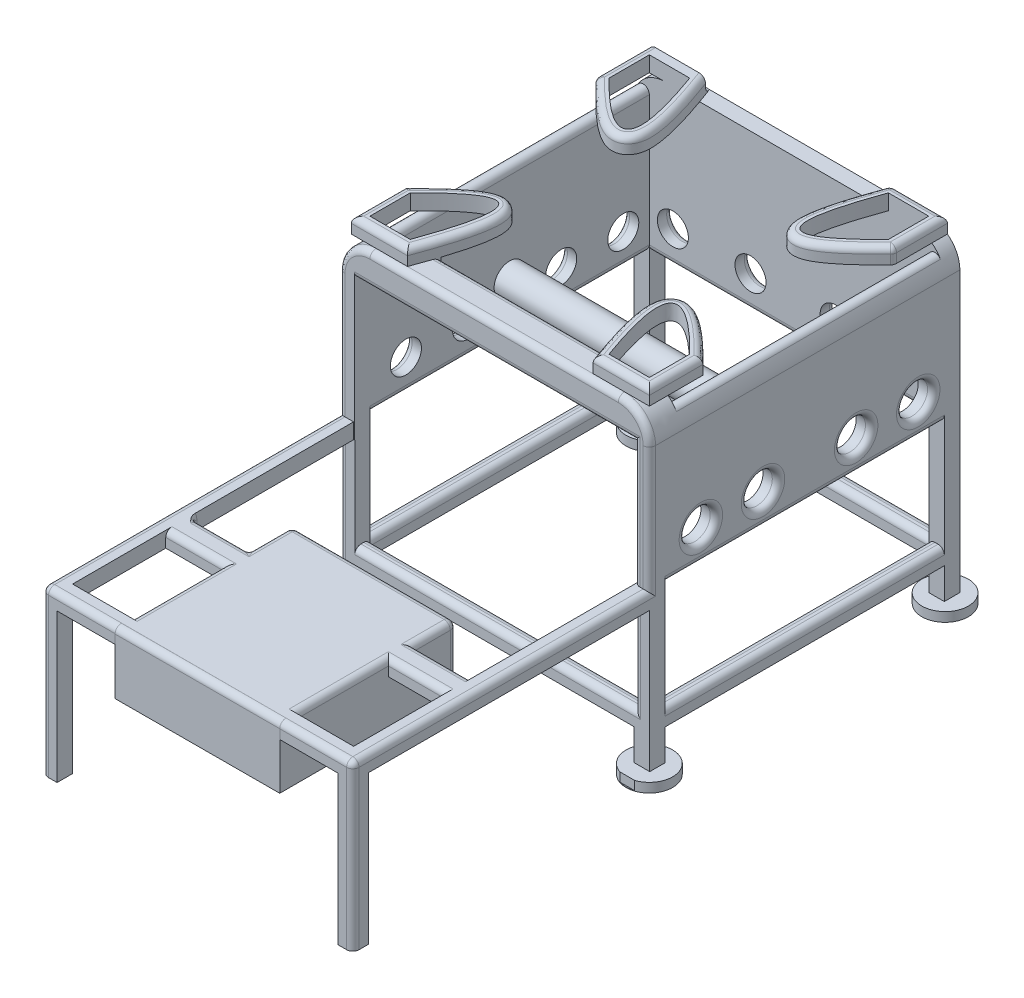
SolidWorks part; units mm, degrees
ref_plane "Front Plane" through (0, 0, 0) normal (0, 0, 1) x (1, 0, 0)
ref_plane "Top Plane" through (0, 0, 0) normal (0, 1, 0) x (1, 0, 0)
ref_plane "Right Plane" through (0, 0, 0) normal (1, 0, 0) x (0, 0, -1)
sketch "Sketch1" plane through (0, 0, 0) normal (0, 0, 1) x (1, 0, 0)
  line L1 (-50, 50) -> (50, 50)
  line L2 (-50, 50) -> (-50, -50)
  line L3 (-50, -50) -> (50, -50)
  line L4 (50, 50) -> (50, -50)
  point P0 (0, 0)
  dimension "D1" = 100
  dimension "D2" = 100
extrude "Boss-Extrude1" add sketch "Sketch1" along normal blind 100
sketch "Sketch2" plane through (0, 0, 100) normal (0, 0, 1) x (1, 0, 0)
  line L0 (50, -50) -> (50, 50) construction
  line L1 (-45, 45) -> (45, 45)
  line L2 (-45, 45) -> (-45, -51.7423)
  line L3 (-45, -51.7423) -> (45, -51.7423)
  line L4 (45, 45) -> (45, -51.7423)
  line L5 (-50, 50) -> (-50, -50) construction
  line L6 (50, 50) -> (-50, 50) construction
  point P6 (-45, -3.3711)
  dimension "D1" = 5
  dimension "D2" = 5
  dimension "D3" = 5
extrude "Cut-Extrude1" cut sketch "Sketch2" against normal blind 95
sketch "Sketch3" plane through (0, 50, 0) normal (0, 1, 0) x (1, 0, 0)
  line L0 (50, -100) -> (50, 0) construction
  line L1 (-45, -5) -> (45, -5)
  line L2 (-45, -5) -> (-45, -104.0415)
  line L3 (-45, -104.0415) -> (45, -104.0415)
  line L4 (45, -5) -> (45, -104.0415)
  line L5 (50, 0) -> (-50, 0) construction
  line L6 (-50, -100) -> (-50, 0) construction
  dimension "D1" = 5
  dimension "D2" = 5
  dimension "D3" = 5
extrude "Cut-Extrude2" cut sketch "Sketch3" against normal blind 95
sketch "Sketch4" plane through (50, 0, 0) normal (1, 0, 0) x (0, 0, -1)
  line L0 (0, -50) -> (0, 50) construction
  line L1 (-95, 0) -> (-5, 0)
  line L2 (-95, 0) -> (-95, -59.8667)
  line L3 (-95, -59.8667) -> (-5, -59.8667)
  line L4 (-5, 0) -> (-5, -59.8667)
  line L5 (-100, -50) -> (-100, 50) construction
  line L6 (-100, 50) -> (0, 50) construction
  dimension "D1" = 5
  dimension "D2" = 5
  dimension "D3" = 50
extrude "Cut-Extrude3" cut sketch "Sketch4" against normal blind 114
sketch "Sketch5" plane through (0, 0, 0) normal (0, 0, -1) x (-1, 0, 0)
  line L0 (50, 50) -> (50, -50) construction
  line L1 (-45, 0) -> (45, 0)
  line L2 (-45, 0) -> (-45, -59.6342)
  line L3 (-45, -59.6342) -> (45, -59.6342)
  line L4 (45, 0) -> (45, -59.6342)
  line L5 (-50, -50) -> (-50, 50) construction
  line L6 (-50, 50) -> (50, 50) construction
  dimension "D1" = 5
  dimension "D2" = 5
  dimension "D3" = 50
extrude "Cut-Extrude4" cut sketch "Sketch5" against normal blind 114
sketch "Sketch6" plane through (0, 0, 100) normal (0, 0, 1) x (1, 0, 0)
  line L0 (45, -50) -> (45, 50) construction
  line L1 (45, -35) -> (50, -35)
  line L2 (45, -35) -> (45, -40)
  line L3 (45, -40) -> (50, -40)
  line L4 (50, -35) -> (50, -40)
  line L5 (50, -50) -> (50, 50) construction
  line L6 (45, -50) -> (50, -50) construction
  dimension "D1" = 10
  dimension "D2" = 5
extrude "Boss-Extrude2" add sketch "Sketch6" against normal blind 100
sketch "Sketch7" plane through (0, 0, 100) normal (0, 0, 1) x (1, 0, 0)
  line L0 (-50, 50) -> (-50, -50) construction
  line L1 (-50, -40) -> (-45, -40)
  line L2 (-50, -40) -> (-50, -35)
  line L3 (-50, -35) -> (-45, -35)
  line L4 (-45, -40) -> (-45, -35)
  line L5 (-45, 50) -> (-45, -50) construction
  line L6 (-50, -50) -> (-45, -50) construction
  dimension "D1" = 10
  dimension "D2" = 5
extrude "Boss-Extrude3" add sketch "Sketch7" against normal blind 100
sketch "Sketch8" plane through (-50, 0, 0) normal (-1, 0, 0) x (0, 0, 1)
  line L0 (100, 50) -> (100, -50) construction
  line L1 (95, -40) -> (100, -40)
  line L2 (95, -40) -> (95, -35)
  line L3 (95, -35) -> (100, -35)
  line L4 (100, -40) -> (100, -35)
  line L6 (100, -50) -> (95, -50) construction
  dimension "D1" = 10
  dimension "D2" = 5
extrude "Boss-Extrude4" add sketch "Sketch8" against normal blind 100
sketch "Sketch9" plane through (-50, 0, 0) normal (-1, 0, 0) x (0, 0, 1)
  line L0 (0, 50) -> (0, -50) construction
  line L1 (5, -35) -> (0, -35)
  line L2 (5, -35) -> (5, -40)
  line L3 (5, -40) -> (0, -40)
  line L4 (0, -35) -> (0, -40)
  line L5 (5, -50) -> (0, -50) construction
  dimension "D1" = 10
  dimension "D2" = 5
extrude "Boss-Extrude5" add sketch "Sketch9" against normal blind 100
sketch "Sketch10" plane through (0, -50, 0) normal (0, -1, 0) x (-1, 0, 0)
  line L0 (0, 0) -> (0, -100) construction
  line L1 (-45, -100) -> (45, -100) construction
  line L2 (-50, -50) -> (50, -50) construction
  line L3 (-50, -5) -> (-50, -95) construction
  line L4 (50, -5) -> (50, -95) construction
  circle A0 centre (47.6303, -97.6238) radius 7.5
  circle A1 centre (47.6303, -2.3762) radius 7.5
  circle A2 centre (-47.6303, -2.3762) radius 7.5
  circle A3 centre (-47.6303, -97.6238) radius 7.5
  dimension "D1" = 15
extrude "Boss-Extrude6" add sketch "Sketch10" along normal blind 3
sketch "Sketch11" plane through (0, 0, 100) normal (0, 0, 1) x (1, 0, 0)
  line L0 (50, -50) -> (50, 50) construction
  line L1 (-50, 50) -> (50, 50)
  line L2 (-50, 50) -> (-50, 40)
  line L3 (-50, 40) -> (50, 40)
  line L4 (50, 50) -> (50, 40)
  dimension "D1" = 10
extrude "Boss-Extrude7" add sketch "Sketch11" against normal blind 10
sketch "Sketch12" plane through (50, 0, 0) normal (1, 0, 0) x (0, 0, -1)
  line L0 (-50, 50) -> (-50, 0) construction
  line L1 (-100, 50) -> (0, 50) construction
  line L2 (-5, 0) -> (-95, 0) construction
  circle A0 centre (-50, 15) radius 5
  dimension "D1" = 10
  dimension "D2" = 15
extrude "Boss-Extrude8" add sketch "Sketch12" against normal blind 100
sketch "Sketch13" plane through (0, 0, 100) normal (0, 0, 1) x (1, 0, 0)
  line L0 (50, -50) -> (50, 50) construction
  line L1 (50, 0) -> (45.2592, 0)
  line L2 (50, 0) -> (50, -52.8656)
  line L3 (50, -52.8656) -> (45.2592, -52.8656)
  line L4 (45.2592, 0) -> (45.2592, -52.8656)
  line L5 (0, 50) -> (0, -62.7077) construction
  line L6 (50, 50) -> (-50, 50) construction
  line L7 (-50, -52.8656) -> (-45.2592, -52.8656)
  line L8 (-50, 0) -> (-45.2592, 0)
  line L9 (-50, 0) -> (-50, -52.8656)
  line L10 (-45.2592, 0) -> (-45.2592, -52.8656)
extrude "Boss-Extrude9" add sketch "Sketch13" along normal blind 95.49
sketch "Sketch14" plane through (50, 0, 0) normal (1, 0, 0) x (0, 0, -1)
  line L0 (-195.49, 0) -> (-100, 0) construction
  line L1 (-190.49, -5) -> (-104.7397, -5)
  line L2 (-190.49, -5) -> (-190.49, -52.8656)
  line L3 (-190.49, -52.8656) -> (-104.7397, -52.8656)
  line L4 (-104.7397, -5) -> (-104.7397, -52.8656)
  line L5 (-195.49, -52.8656) -> (-195.49, 0) construction
  dimension "D1" = 5
  dimension "D2" = 5
extrude "Cut-Extrude5" cut sketch "Sketch14" against normal blind 147.49
sketch "Sketch15" plane through (50, 0, 0) normal (1, 0, 0) x (0, 0, -1)
  line L1 (-195.49, 0) -> (-190.49, 0)
  line L2 (-195.49, 0) -> (-195.49, -5)
  line L3 (-195.49, -5) -> (-190.49, -5)
  line L4 (-190.49, 0) -> (-190.49, -5)
extrude "Boss-Extrude10" add sketch "Sketch15" against normal blind 100
sketch "Sketch18" plane through (0, 0, 0) normal (0, 1, 0) x (1, 0, 0)
  line L0 (-50, -195.49) -> (-50, -100) construction
  line L1 (50, -195.49) -> (-50, -195.49)
  line L2 (50, -195.49) -> (50, -152.49)
  line L3 (50, -152.49) -> (-50, -152.49)
  line L4 (-50, -195.49) -> (-50, -152.49)
  line L5 (-50, -160.49) -> (50, -160.49)
  line L6 (-50, -152.49) -> (-50, -160.49)
  line L7 (50, -152.49) -> (50, -160.49)
  dimension "D1" = 43
  dimension "D2" = 8
extrude "Boss-Extrude11" add sketch "Sketch18" against normal blind 5 contours L5 L3 M6 M4
sketch "Sketch19" plane through (50, 0, 0) normal (1, 0, 0) x (0, 0, -1)
  line L0 (-104.7397, -50) -> (-95, -50) construction
  line L1 (-104.7397, -5) -> (-99.8698, -5)
  line L2 (-104.7397, -5) -> (-104.7397, -50)
  line L3 (-104.7397, -50) -> (-99.8698, -50)
  line L4 (-99.8698, -5) -> (-99.8698, -50)
extrude "Cut-Extrude8" cut sketch "Sketch19" against normal blind 127
sketch "Sketch20" plane through (0, 0, 0) normal (0, 1, 0) x (1, 0, 0)
  line L0 (0, -160.49) -> (0, -190.49) construction
  line L1 (-45.2592, -160.49) -> (45.2592, -160.49) construction
  line L2 (-45.2592, -190.49) -> (45.2592, -190.49) construction
  line L3 (-26.4602, -195.607) -> (26.4602, -195.49)
  line L5 (-26.4602, -195.607) -> (-26.4602, -138.5589)
  line L6 (-26.4602, -138.5589) -> (26.4602, -138.5589)
  line L7 (26.4602, -195.49) -> (26.4602, -138.5589)
  line L8 (-14.3942, -195.5803) -> (26.4602, -138.5589) construction
  line L9 (-26.4602, -138.5589) -> (14.3487, -195.5168) construction
  line L10 (50, -195.49) -> (-50, -195.49) construction
  point P6 (0, -175.49)
  point P7 (0, -175.49)
extrude "Boss-Extrude16" add sketch "Sketch20" against normal blind 20
fillet "Fillet10" radius 10 1 edges at (50, 50, 50)
fillet "Fillet11" radius 10 1 edges at (-50, 50, 50)
sketch "Sketch21" plane through (0, 50, 0) normal (0, 1, 0) x (1, 0, 0)
  line L0 (0, 0) -> (0, -100) construction
  line L1 (40, -100) -> (-40, -100) construction
  line L2 (-50, -50) -> (50, -50) construction
  line L3 (-50, 0) -> (-50, -100) construction
  line L4 (50, -100) -> (50, 0) construction
sketch "Sketch22" plane through (0, 50, 0) normal (0, 1, 0) x (1, 0, 0)
  line L0 (-45, -5) -> (-45, -90) construction
  line L1 (40, -5) -> (-40, -5) construction
  line L2 (-45, -18) -> (-45, -5)
  line L3 (-45, -5) -> (-32, -5)
  line L4 (-48, -2) -> (-29.8949, -2)
  line L5 (-48, -19.2202) -> (-48, -2)
  line L6 (0, 0) -> (0, -100) construction
  line L7 (40, -100) -> (-40, -100) construction
  line L8 (-50, -50) -> (50, -50) construction
  line L9 (48, -19.2202) -> (48, -2)
  line L10 (45, -18) -> (45, -5)
  line L11 (48, -2) -> (29.8949, -2)
  line L12 (45, -5) -> (32, -5)
  line L13 (48, -98) -> (29.8949, -98)
  line L14 (45, -95) -> (32, -95)
  line L15 (45, -82) -> (45, -95)
  line L16 (48, -80.7798) -> (48, -98)
  line L17 (-45, -82) -> (-45, -95)
  line L18 (-48, -80.7798) -> (-48, -98)
  line L19 (-48, -98) -> (-29.8949, -98)
  line L20 (-45, -95) -> (-32, -95)
  spline S0 degree 2 poles (-45, -18) (-16.8532, -46.8772) (-32, -5) knots 0 0 0 1 1 1
  spline S1 degree 1 poles (-48, -19.2202) (-29.8949, -2) knots 0 0 1 1 construction
  spline S2 degree 2 poles (-48, -19.2202) (-47.3163, -19.9243) (-45.9352, -21.3307) (-43.9469, -23.3042) (-41.0728, -26.0003) (-38.1131, -28.5111) (-35.4451, -30.4652) (-33.0013, -31.8775) (-30.9101, -32.6326) (-29.2998, -32.8217) (-27.9195, -32.6835) (-26.5384, -32.1399) (-25.379, -31.2) (-24.5785, -30.0485) (-23.9697, -28.5332) (-23.6551, -26.3386) (-23.772, -23.5467) (-24.397, -19.509) (-25.9628, -13.4998) (-27.7421, -8.0436) (-28.7852, -5.0687) (-29.5272, -3.0162) (-29.8949, -2) knots -0.015129 -0.015129 -0.015129 0.009217 0.033563 0.082255 0.147178 0.212101 0.277023 0.341946 0.390638 0.4231 0.455561 0.488023 0.520484 0.552945 0.601638 0.66656 0.731483 0.828867 0.926252 0.974944 0.99929 1.023636 1.023636 1.023636
  spline S3 degree 2 poles (45, -18) (16.8532, -46.8772) (32, -5) knots 0 0 0 1 1 1
  spline S4 degree 2 poles (48, -19.2202) (47.3163, -19.9243) (45.9352, -21.3307) (43.9469, -23.3042) (41.0728, -26.0003) (38.1131, -28.5111) (35.4451, -30.4652) (33.0013, -31.8775) (30.9101, -32.6326) (29.2998, -32.8217) (27.9195, -32.6835) (26.5384, -32.1399) (25.379, -31.2) (24.5785, -30.0485) (23.9697, -28.5332) (23.6551, -26.3386) (23.772, -23.5467) (24.397, -19.509) (25.9628, -13.4998) (27.7421, -8.0436) (28.7852, -5.0687) (29.5272, -3.0162) (29.8949, -2) knots -0.015129 -0.015129 -0.015129 0.009217 0.033563 0.082255 0.147178 0.212101 0.277023 0.341946 0.390638 0.4231 0.455561 0.488023 0.520484 0.552945 0.601638 0.66656 0.731483 0.828867 0.926252 0.974944 0.99929 1.023636 1.023636 1.023636
  spline S5 degree 2 poles (48, -80.7798) (47.3163, -80.0757) (45.9352, -78.6693) (43.9469, -76.6958) (41.0728, -73.9997) (38.1131, -71.4889) (35.4451, -69.5348) (33.0013, -68.1225) (30.9101, -67.3674) (29.2998, -67.1783) (27.9195, -67.3165) (26.5384, -67.8601) (25.379, -68.8) (24.5785, -69.9515) (23.9697, -71.4668) (23.6551, -73.6614) (23.772, -76.4533) (24.397, -80.491) (25.9628, -86.5002) (27.7421, -91.9564) (28.7852, -94.9313) (29.5272, -96.9838) (29.8949, -98) knots -0.015129 -0.015129 -0.015129 0.009217 0.033563 0.082255 0.147178 0.212101 0.277023 0.341946 0.390638 0.4231 0.455561 0.488023 0.520484 0.552945 0.601638 0.66656 0.731483 0.828867 0.926252 0.974944 0.99929 1.023636 1.023636 1.023636
  spline S6 degree 2 poles (45, -82) (16.8532, -53.1228) (32, -95) knots 0 0 0 1 1 1
  spline S7 degree 2 poles (-45, -82) (-16.8532, -53.1228) (-32, -95) knots 0 0 0 1 1 1
  spline S8 degree 2 poles (-48, -80.7798) (-47.3163, -80.0757) (-45.9352, -78.6693) (-43.9469, -76.6958) (-41.0728, -73.9997) (-38.1131, -71.4889) (-35.4451, -69.5348) (-33.0013, -68.1225) (-30.9101, -67.3674) (-29.2998, -67.1783) (-27.9195, -67.3165) (-26.5384, -67.8601) (-25.379, -68.8) (-24.5785, -69.9515) (-23.9697, -71.4668) (-23.6551, -73.6614) (-23.772, -76.4533) (-24.397, -80.491) (-25.9628, -86.5002) (-27.7421, -91.9564) (-28.7852, -94.9313) (-29.5272, -96.9838) (-29.8949, -98) knots -0.015129 -0.015129 -0.015129 0.009217 0.033563 0.082255 0.147178 0.212101 0.277023 0.341946 0.390638 0.4231 0.455561 0.488023 0.520484 0.552945 0.601638 0.66656 0.731483 0.828867 0.926252 0.974944 0.99929 1.023636 1.023636 1.023636
  dimension "D1" = 13
  dimension "D2" = 13
  dimension "D3" = 3
extrude "Boss-Extrude17" add sketch "Sketch22" along normal blind 5
fillet "Fillet13" radius 2 1 edges
fillet "Fillet14" radius 2 6 edges at (48, 51.5, 19.2202) (48, 54.3446, 18.4746) (29.8949, 51.5, 2) (30.3151, 54.1936, 2) (48, 55, 9.1747) (40.0109, 55, 2)
fillet "Fillet15" radius 2 3 edges at (38.9474, 55, 98) (48, 55, 89.3899)
fillet "Fillet16" radius 2 3 edges at (-48, 55, 89.3899) (-38.9474, 55, 98)
fillet "Fillet17" radius 2 1 edges
fillet "Fillet18" radius 2 8 edges at (-48, 55, 9.1747) (-27.344, 55, 30.2128) (-48, 51.5, 19.2202) (-48, 53.9728, 18.8577)
fillet "Fillet20" radius 2 1 edges at (-50, 0, 147.745)
fillet "Fillet21" radius 2 1 edges at (50, 0, 147.745)
fillet "Fillet22" radius 2 4 edges at (50, -27.4328, 195.49) (49.4142, -0.5858, 195.49) (37.2301, 0, 195.49) (0, 0, 195.5485)
fillet "Fillet23" radius 2 4 edges at (-50, -27.4328, 195.49) (-49.9574, -1.5893, 195.49) (-37.6325, -1.2605, 195.49) (-49.0936, -0.3255, 194.7507)
fillet "Fillet24" radius 2 1 edges at (50, -35, 50)
fillet "Fillet25" radius 2 1 edges at (0, -35, 95)
fillet "Fillet27" radius 2 1 edges at (-50, -35, 50)
fillet "Fillet28" radius 2 1 edges at (-45, -35, 50)
fillet "Fillet29" radius 2 1 edges at (0, -35, 99.8698)
fillet "Fillet31" radius 2 1 edges at (0, -35, 0)
fillet "Fillet33" radius 2 1 edges at (0, -35, 5)
fillet "Fillet34" radius 2 1 edges at (-35.8597, 0, 160.49)
fillet "Fillet35" radius 2 1 edges at (35.8597, 0, 160.49)
fillet "Fillet36" radius 2 1 edges at (35.8597, 0, 152.49)
fillet "Fillet37" radius 2 1 edges at (-35.8597, 0, 152.49)
fillet "Fillet38" radius 2 4 edges at (-26.4602, -10, 138.5589) (0, -20, 138.5589) (26.4602, -10, 138.5589) (0, 0, 138.5589)
fillet "Fillet39" radius 2 1 edges at (-26.4602, 0, 174.49)
fillet "Fillet40" radius 2 2 edges at (-25.8744, -0.5858, 139.1447) (-26.4602, 0, 147.5245)
fillet "Fillet41" radius 2 2 edges at (25.8744, -0.5858, 139.1447) (26.4602, 0, 147.5245)
fillet "Fillet42" radius 2 1 edges at (26.4602, 0, 174.49)
fillet "Fillet44" radius 2 10 edges at (50, 19, 100) (0, 50, 100) (47.8087, 46.2469, 100) (-50, 19, 100) (-46.2469, 47.8087, 100) (-49.4142, -0.5858, 100) (49.4142, -0.5858, 100)
fillet "Fillet45" radius 2 1 edges at (-50, -27.5, 99.8698)
fillet "Fillet46" radius 2 1 edges at (45, -21, 99.8698)
fillet "Fillet47" radius 2 1 edges at (45, 17.5, 100)
fillet "Fillet48" radius 2 1 edges at (1, 40, 100)
fillet "Fillet52" radius 2 1 edges at (0, 50, 90)
fillet "Fillet53" radius 2 1 edges at (0, 40, 90)
fillet "Fillet54" radius 2 1 edges at (45, 48.6603, 47.5)
fillet "Fillet55" radius 2 5 edges at (-45.2592, -3.5, 152.49) (-26.4602, -3.5, 152.49) (-45.2592, -0.5858, 153.0758) (-25.8744, -0.5858, 153.0758) (-45, 48.6603, 47.5)
fillet "Fillet56" radius 2 1 edges at (45, -35, 50)
fillet "Fillet57" radius 2 1 edges at (-50, 0, 50)
fillet "Fillet58" radius 2 1 edges at (-45, 0, 50)
fillet "Fillet59" radius 2 1 edges at (0, 0, 5)
fillet "Fillet60" radius 2 1 edges at (0, 0, 0)
fillet "Fillet61" radius 2 1 edges at (45, 0, 50)
fillet "Fillet62" radius 2 1 edges at (50, 0, 50)
sketch "Sketch23" plane through (-50, 0, 0) normal (-1, 0, 0) x (0, 0, 1)
  line L0 (0, 9.901) -> (98, 9.901) construction
  line L1 (0, 40) -> (0, -50) construction
  line L2 (98, -2) -> (98, 40) construction
  circle A0 centre (13.3978, 9.901) radius 5
  circle A1 centre (33.3978, 9.901) radius 5
  circle A2 centre (63.3978, 9.901) radius 5
  circle A3 centre (83.3978, 9.901) radius 5
  dimension "D1" = 10
  dimension "D2" = 10
  dimension "D3" = 10
  dimension "D4" = 10
  dimension "D5" = 20
  dimension "D6" = 20
  dimension "D7" = 30
extrude "Cut-Extrude9" cut sketch "Sketch23" against normal blind 100
fillet "Fillet63" radius 2 1 edges at (-50, 4.901, 83.3978)
fillet "Fillet64" radius 2 1 edges at (-50, 4.901, 63.3978)
fillet "Fillet65" radius 2 1 edges at (-50, 4.901, 33.3978)
fillet "Fillet66" radius 2 1 edges at (-50, 4.901, 13.3978)
fillet "Fillet67" radius 2 1 edges at (50, 4.901, 83.3978)
fillet "Fillet68" radius 2 1 edges at (50, 4.901, 63.3978)
fillet "Fillet69" radius 2 1 edges at (50, 4.901, 33.3978)
fillet "Fillet70" radius 2 1 edges at (50, 4.901, 13.3978)
sketch "Sketch24" plane through (0, 0, 0) normal (0, 0, -1) x (-1, 0, 0)
  line L0 (-50, 10.2418) -> (50, 10.2418) construction
  line L1 (-50, -50) -> (-50, 40) construction
  line L2 (50, 40) -> (50, -50) construction
  circle A0 centre (-35.0052, 10.2418) radius 5
  circle A1 centre (-15.0052, 10.2418) radius 5
  circle A2 centre (12.4161, 10.2418) radius 5
  circle A3 centre (37.4161, 10.2418) radius 5
  dimension "D1" = 10
  dimension "D2" = 10
  dimension "D4" = 10
  dimension "D5" = 10
  dimension "D3" = 25
  dimension "D6" = 20
extrude "Cut-Extrude10" cut sketch "Sketch24" against normal blind 10
fillet "Fillet71" radius 2 1 edges at (30.0052, 10.2418, 0)
fillet "Fillet72" radius 2 1 edges at (10.0052, 10.2418, 0)
fillet "Fillet73" radius 2 1 edges at (-17.4161, 10.2418, 0)
fillet "Fillet74" radius 2 1 edges at (-42.4161, 10.2418, 0)
